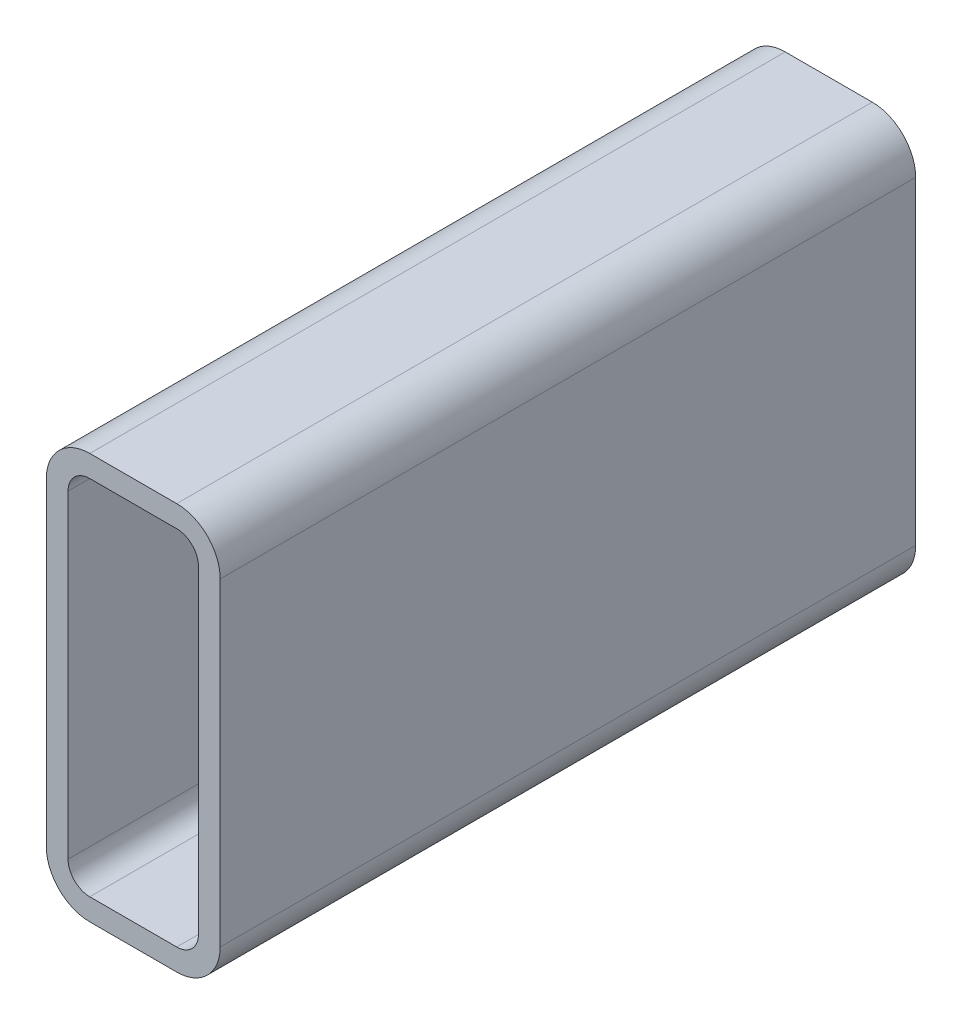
SolidWorks part; units mm, degrees
ref_plane "Front Plane" through (0, 0, 0) normal (0, 0, 1) x (1, 0, 0)
ref_plane "Top Plane" through (0, 0, 0) normal (0, 1, 0) x (1, 0, 0)
ref_plane "Right Plane" through (0, 0, 0) normal (1, 0, 0) x (0, 0, -1)
sketch "Sketch1" plane through (0, 0, 0) normal (0, 0, 1) x (1, 0, 0)
sketch_block_instance "HSS7x3x0.375-1"
sketch_block "HSS7x3x0.375"
extrude "Boss-Extrude1" add sketch "Sketch1" along normal blind 304.8
